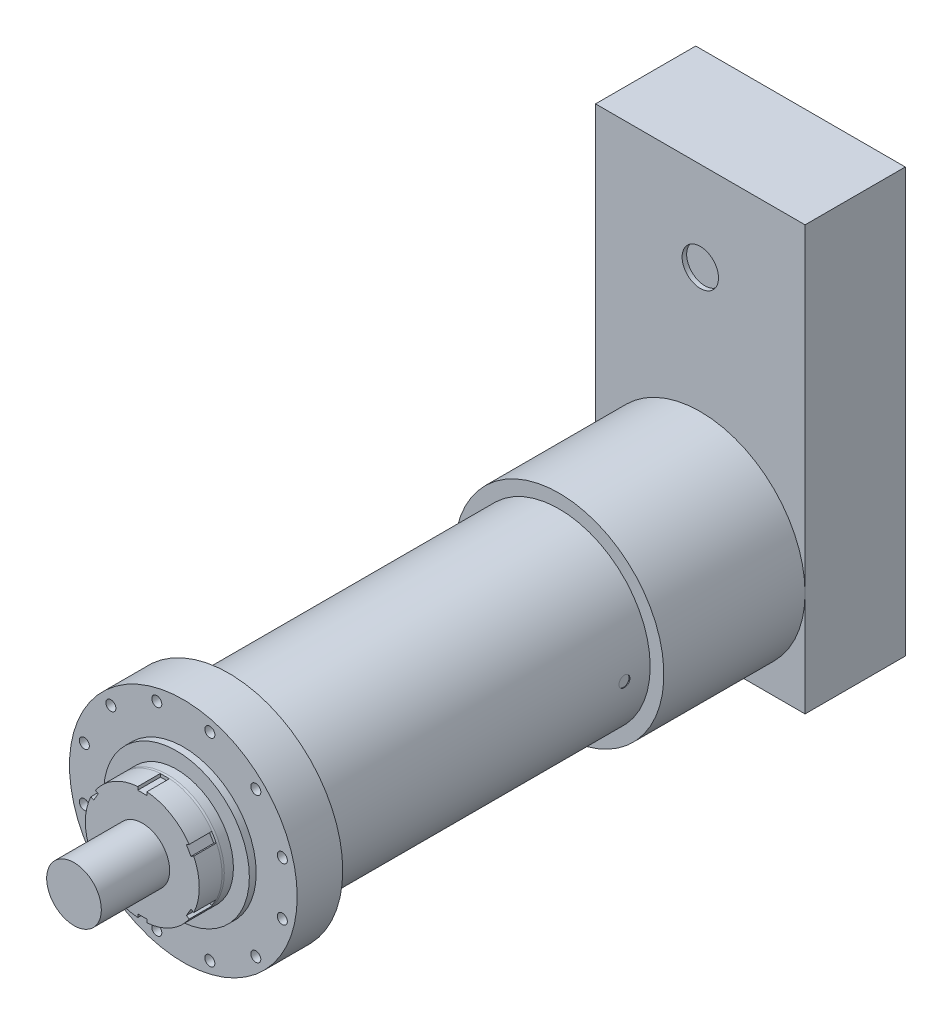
SolidWorks part; units mm, degrees
ref_plane "前视基准面" through (0, 0, 0) normal (0, 0, 1) x (1, 0, 0)
ref_plane "上视基准面" through (0, 0, 0) normal (0, 1, 0) x (1, 0, 0)
ref_plane "右视基准面" through (0, 0, 0) normal (1, 0, 0) x (0, 0, -1)
sketch "草图1" plane through (0, 0, 0) normal (0, 0, 1) x (1, 0, 0)
  circle A0 centre (0, 0) radius 200
  dimension "D1" = 400
extrude "凸台-拉伸1" add sketch "草图1" along normal blind 725
sketch "草图2" plane through (0, 0, 725) normal (0, 0, 1) x (1, 0, 0)
  line L0 (0, 0) -> (351.3656, 0) construction
  line L1 (0, 0) -> (299.4379, 80.2342) construction
  circle A0 centre (0, 0) radius 250
  circle A1 centre (0, 0) radius 225 construction
  circle A2 centre (217.3333, 58.2343) radius 11
  circle A3 centre (217.3333, -58.2343) radius 11
  circle A4 centre (159.099, -159.099) radius 11
  circle A5 centre (58.2343, -217.3333) radius 11
  circle A6 centre (-58.2343, -217.3333) radius 11
  circle A7 centre (-159.099, -159.099) radius 11
  circle A8 centre (-217.3333, -58.2343) radius 11
  circle A9 centre (-217.3333, 58.2343) radius 11
  circle A10 centre (-159.099, 159.099) radius 11
  circle A11 centre (-58.2343, 217.3333) radius 11
  circle A12 centre (58.2343, 217.3333) radius 11
  circle A13 centre (159.099, 159.099) radius 11
  point P32 (0, 0)
  dimension "D1" = 500
  dimension "D2" = 450
  dimension "D4" = 22
  dimension "D3" = 15
  dimension "D5" = 12
extrude "凸台-拉伸2" add sketch "草图2" along normal blind 100
sketch "草图3" plane through (0, 0, 825) normal (0, 0, 1) x (1, 0, 0)
  circle A0 centre (0, 0) radius 160
  dimension "D1" = 320
extrude "凸台-拉伸3" add sketch "草图3" along normal blind 15
sketch "草图4" plane through (0, 0, 840) normal (0, 0, 1) x (1, 0, 0)
  circle A1 centre (0, 0) radius 125
  dimension "D1" = 250
extrude "凸台-拉伸4" add sketch "草图4" along normal blind 25
chamfer "倒角1" distance 5 angle 10 1 edges at (125, 0, 865)
sketch "草图5" plane through (0, 0, 865) normal (0, 0, 1) x (1, 0, 0)
  line L0 (-10, 124.5994) -> (-10, 117.5)
  line L1 (-10, 117.5) -> (10, 117.5)
  line L2 (10, 117.5) -> (10, 124.5994)
  line L3 (102.9062, 70.9599) -> (96.758, 67.4103)
  line L4 (96.758, 67.4103) -> (106.758, 50.0897)
  line L5 (106.758, 50.0897) -> (112.9062, 53.6394)
  line L6 (112.9062, -53.6394) -> (106.758, -50.0897)
  line L7 (106.758, -50.0897) -> (96.758, -67.4103)
  line L8 (96.758, -67.4103) -> (102.9062, -70.9599)
  line L9 (10, -124.5994) -> (10, -117.5)
  line L10 (10, -117.5) -> (-10, -117.5)
  line L11 (-10, -117.5) -> (-10, -124.5994)
  line L12 (-102.9062, -70.9599) -> (-96.758, -67.4103)
  line L13 (-96.758, -67.4103) -> (-106.758, -50.0897)
  line L14 (-106.758, -50.0897) -> (-112.9062, -53.6394)
  line L15 (-112.9062, 53.6394) -> (-106.758, 50.0897)
  line L16 (-106.758, 50.0897) -> (-96.758, 67.4103)
  line L17 (-96.758, 67.4103) -> (-102.9062, 70.9599)
  arc A0 (-10, 124.5994) -> (-102.9062, 70.9599) centre (0, 0) ccw
  arc A1 (-112.9062, 53.6394) -> (-112.9062, -53.6394) centre (0, 0) ccw
  arc A2 (-102.9062, -70.9599) -> (-10, -124.5994) centre (0, 0) ccw
  arc A3 (10, -124.5994) -> (102.9062, -70.9599) centre (0, 0) ccw
  arc A4 (112.9062, -53.6394) -> (112.9062, 53.6394) centre (0, 0) ccw
  arc A5 (102.9062, 70.9599) -> (10, 124.5994) centre (0, 0) ccw
  point P28 (0, 0)
  dimension "D1" = 250
  dimension "D2" = 20
  dimension "D3" = 10
  dimension "D4" = 117.5
  dimension "D5" = 6
sketch "草图6" plane through (0, 0, 0) normal (0, 0, -1) x (-1, 0, 0)
  circle A0 centre (0, 0) radius 230
  dimension "D1" = 460
extrude "凸台-拉伸6" add sketch "草图6" along normal blind 310
ref_plane "基准面1" through (-200, 0, 0) normal (1, 0, 0) x (0, 0, -1)
sketch "草图9" plane through (-200, 0, 0) normal (1, 0, 0) x (0, 0, -1)
  line L0 (-725, -200) -> (-725, 200) construction
  circle A0 centre (-36.5, 0) radius 12
  circle A1 centre (-670.5, 0) radius 12
  dimension "D1" = 24
  dimension "D2" = 24
  dimension "D3" = 36.5
  dimension "D4" = 54.5
extrude "切除-拉伸2" cut sketch "草图9" along normal blind 2
ref_plane "基准面2" through (200, 0, 0) normal (1, 0, 0) x (0, 0, -1)
sketch "草图10" plane through (200, 0, 0) normal (1, 0, 0) x (0, 0, -1)
  circle A0 centre (-56.5, 0) radius 12
  dimension "D1" = 56.5
  dimension "D2" = 24
extrude "切除-拉伸3" cut sketch "草图10" against normal blind 2
extrude "凸台-拉伸7" add sketch "草图5" along normal blind 50
sketch "草图11" plane through (0, 0, 915) normal (0, 0, 1) x (1, 0, 0)
  circle A0 centre (0, 0) radius 60
  dimension "D1" = 120
extrude "凸台-拉伸8" add sketch "草图11" along normal blind 150
sketch "草图12" plane through (0, 0, -310) normal (0, 0, -1) x (-1, 0, 0)
  line L1 (-230, 700) -> (230, 700)
  line L2 (-230, 700) -> (-230, -230)
  line L3 (-230, -230) -> (230, -230)
  line L4 (230, 700) -> (230, -230)
  line L5 (-230, 700) -> (230, -230) construction
  line L6 (-230, -230) -> (230, 700) construction
  point P0 (0, 235)
  point P5 (0, 150.9292)
  point P6 (0, 0)
  dimension "D1" = 460
  dimension "D2" = 930
  dimension "D3" = 230
extrude "凸台-拉伸9" add sketch "草图12" along normal blind 220
sketch "草图13" plane through (0, 0, -310) normal (0, 0, 1) x (1, 0, 0)
  line L0 (-230, 700) -> (230, 700) construction
  circle A0 centre (0, 504) radius 40
  dimension "D1" = 80
  dimension "D2" = 196
extrude "切除-拉伸4" cut sketch "草图13" against normal blind 10 contours A0
